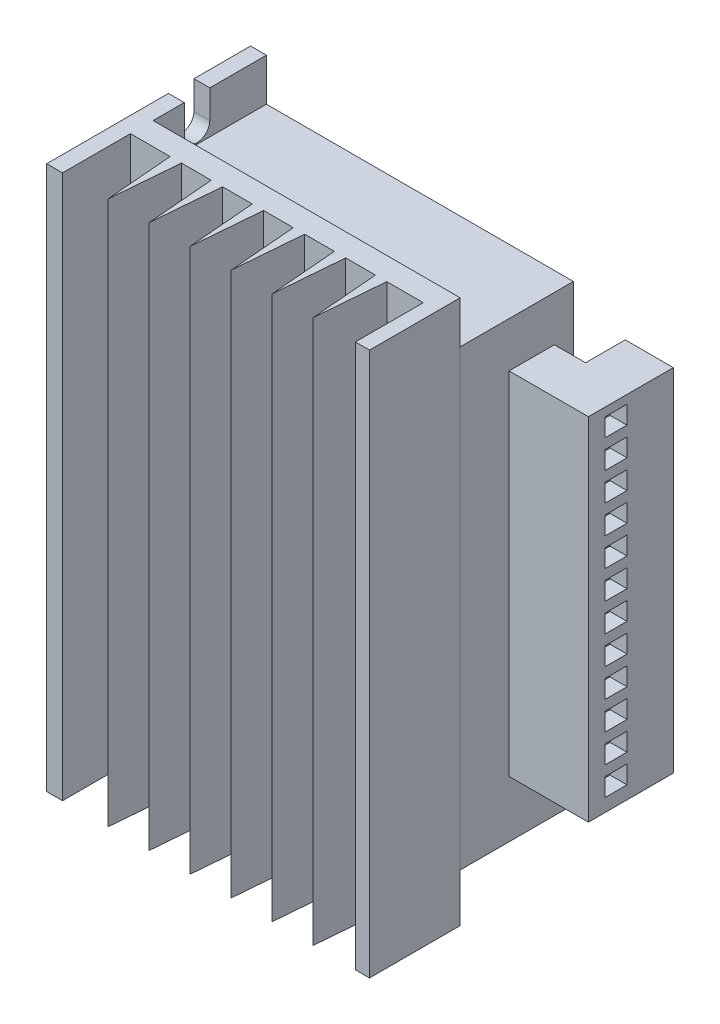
SolidWorks part; units mm, degrees
ref_plane "Front Plane" through (0, 0, 0) normal (0, 0, 1) x (1, 0, 0)
ref_plane "Top Plane" through (0, 0, 0) normal (0, 1, 0) x (1, 0, 0)
ref_plane "Right Plane" through (0, 0, 0) normal (1, 0, 0) x (0, 0, -1)
sketch "Sketch1" plane through (0, 0, 0) normal (0, 1, 0) x (1, 0, 0)
  line L0 (2.8, 16) -> (57, 16)
  line L1 (54.5, 0) -> (57, 0)
  line L2 (0, 36) -> (0, 0)
  line L3 (2.8, 12) -> (9.8, 12)
  line L4 (57, 0) -> (57, 16)
  line L5 (0, 0) -> (2.8, 0)
  line L7 (0, 36) -> (2.8, 36)
  line L8 (2.8, 16) -> (2.8, 36)
  line L9 (2.8, 12) -> (2.8, 0)
  line L10 (18.05, 0) -> (17.05, 12)
  line L11 (18.05, 0) -> (19.05, 12)
  line L12 (25.3, 0) -> (24.3, 12)
  line L13 (10.8, 0) -> (9.8, 12)
  line L14 (10.8, 0) -> (11.8, 12)
  line L15 (25.3, 0) -> (26.3, 12)
  line L16 (32.55, 0) -> (31.55, 12)
  line L17 (32.55, 0) -> (33.55, 12)
  line L18 (39.8, 0) -> (38.8, 12)
  line L19 (39.8, 0) -> (40.8, 12)
  line L20 (47.05, 0) -> (46.05, 12)
  line L21 (47.05, 0) -> (48.05, 12)
  line L22 (54.5, 0) -> (54.5, 12)
  line L23 (54.5, 0) -> (54.5, 16) construction
  line L24 (2.8, 12) -> (57, 12) construction
  line L25 (48.05, 12) -> (54.5, 12)
  line L26 (40.8, 12) -> (46.05, 12)
  line L27 (33.55, 12) -> (38.8, 12)
  line L28 (26.3, 12) -> (31.55, 12)
  line L29 (19.05, 12) -> (24.3, 12)
  line L30 (11.8, 12) -> (17.05, 12)
  dimension "D1" = 6
extrude "Boss-Extrude1" add sketch "Sketch1" along normal blind 96
sketch "Sketch2" plane through (2.8, 0, 0) normal (1, 0, 0) x (0, 0, -1)
  line L4 (16, 96) -> (16, 0) construction
  line L5 (36, 96) -> (36, 0) construction
  line L6 (16, 88.5) -> (36, 88.5)
  line L7 (16, 88.5) -> (16, 8.5)
  line L8 (16, 8.5) -> (36, 8.5)
  line L9 (36, 88.5) -> (36, 8.5)
extrude "Boss-Extrude2" add sketch "Sketch2" along normal blind 54.2 separate body contours L8 L6 M5 M3
sketch "Sketch8" plane through (2.8, 0, 0) normal (1, 0, 0) x (0, 0, -1)
  line L0 (26, 96) -> (26, 91)
  line L1 (16, 96) -> (36, 96) construction
  line L2 (21.5, 96) -> (21.5, 91)
  line L3 (21.5, 96) -> (26, 96)
  line L6 (21.5, 0) -> (26, 0)
  line L7 (21.5, 0) -> (21.5, 5)
  line L8 (26, 0) -> (26, 5)
  arc A0 (26, 91) -> (21.5, 91) centre (23.75, 91) cw
  arc A1 (26, 5) -> (21.5, 5) centre (23.75, 5) ccw
extrude "Cut-Extrude1" cut sketch "Sketch8" against normal blind 4 contours A0 L0 L2 M8 | L8 A1 L7 M6
sketch "Sketch9" plane through (57, 0, 0) normal (1, 0, 0) x (0, 0, -1)
  line L0 (16, 88.5) -> (36, 88.5) construction
  line L1 (24.6447, 80.5) -> (32.6447, 80.5)
  line L2 (24.6447, 80.5) -> (24.6447, 18.5)
  line L3 (24.6447, 18.5) -> (32.6447, 18.5)
  line L4 (32.6447, 80.5) -> (32.6447, 18.5)
  dimension "D1" = 62
  dimension "D2" = 8
  dimension "D3" = 8
extrude "Boss-Extrude4" add sketch "Sketch9" along normal blind 14 separate body
sketch "Sketch10" plane through (71, 0, 0) normal (1, 0, 0) x (0, 0, -1)
  line L2 (24.6447, 80.5) -> (39.6447, 80.5)
  line L3 (24.6447, 80.5) -> (24.6447, 18.5)
  line L4 (24.6447, 18.5) -> (39.6447, 18.5)
  line L7 (39.6447, 80.5) -> (39.6447, 18.5)
extrude "Boss-Extrude5" add sketch "Sketch10" against normal blind 8.5
sketch "Sketch11" plane through (0, 0, -39.6447) normal (0, 0, -1) x (-1, 0, 0)
  circle A0 centre (-66.1245, 77.4968) radius 1.6
  circle A1 centre (-66.1245, 72.4968) radius 1.6
  circle A2 centre (-66.1245, 67.4968) radius 1.6
  circle A3 centre (-66.1245, 62.4968) radius 1.6
  circle A4 centre (-66.1245, 57.4968) radius 1.6
  circle A5 centre (-66.1245, 52.4968) radius 1.6
  circle A6 centre (-66.1245, 47.4968) radius 1.6
  circle A7 centre (-66.1245, 42.4968) radius 1.6
  circle A8 centre (-66.1245, 37.4968) radius 1.6
  circle A9 centre (-66.1245, 32.4968) radius 1.6
  circle A10 centre (-66.1245, 27.4968) radius 1.6
  circle A11 centre (-66.1245, 22.4968) radius 1.6
extrude "Cut-Extrude2" cut sketch "Sketch11" against normal blind 1
sketch "Sketch13" plane through (0, 0, -38.6447) normal (0, 0, -1) x (-1, 0, 0)
  circle A0 centre (-66.1245, 77.4968) radius 1.5085
  circle A1 centre (-66.1245, 72.4968) radius 1.5085
  circle A2 centre (-66.1245, 67.4968) radius 1.5085
  circle A3 centre (-66.1245, 62.4968) radius 1.5085
  circle A4 centre (-66.1245, 57.4968) radius 1.5085
  circle A5 centre (-66.1245, 52.4968) radius 1.5085
  circle A6 centre (-66.1245, 47.4968) radius 1.5085
  circle A7 centre (-66.1245, 42.4968) radius 1.5085
  circle A8 centre (-66.1245, 37.4968) radius 1.5085
  circle A9 centre (-66.1245, 32.4968) radius 1.5085
  circle A10 centre (-66.1245, 27.4968) radius 1.5085
  circle A11 centre (-66.1245, 22.4968) radius 1.5085
extrude "Boss-Extrude6" add sketch "Sketch13" along normal blind 0.5 separate body
fillet "Fillet19" radius 0.5 1 edges at (66.1245, 79.0053, -39.1447)
fillet "Fillet20" radius 0.5 1 edges at (66.1245, 74.0053, -39.1447)
fillet "Fillet21" radius 0.5 1 edges at (66.1245, 69.0053, -39.1447)
fillet "Fillet22" radius 0.5 1 edges at (66.1245, 64.0053, -39.1447)
fillet "Fillet23" radius 0.5 1 edges at (66.1245, 59.0053, -39.1447)
fillet "Fillet24" radius 0.5 1 edges at (66.1245, 54.0053, -39.1447)
fillet "Fillet25" radius 0.5 1 edges at (66.1245, 49.0053, -39.1447)
fillet "Fillet26" radius 0.5 1 edges at (66.1245, 44.0053, -39.1447)
fillet "Fillet27" radius 0.5 1 edges at (66.1245, 39.0053, -39.1447)
fillet "Fillet28" radius 0.5 1 edges at (66.1245, 34.0053, -39.1447)
fillet "Fillet29" radius 0.5 1 edges at (66.1245, 29.0053, -39.1447)
fillet "Fillet30" radius 0.5 1 edges at (66.1245, 24.0053, -39.1447)
sketch "Sketch15" plane through (0, 0, -39.1447) normal (0, 0, -1) x (-1, 0, 0)
  line L0 (-65.5267, 71.1211) -> (-66.2369, 73.9926)
  line L1 (-65.5267, 76.1211) -> (-66.2369, 78.9926)
  line L2 (-66.012, 76.001) -> (-66.7223, 78.8725)
  line L3 (-66.012, 71.001) -> (-66.7223, 73.8725)
  line L4 (-65.5267, 66.1211) -> (-66.2369, 68.9926)
  line L5 (-66.012, 66.001) -> (-66.7223, 68.8725)
  line L6 (-65.5267, 61.1211) -> (-66.2369, 63.9926)
  line L7 (-66.012, 61.001) -> (-66.7223, 63.8725)
  line L8 (-65.5267, 56.1211) -> (-66.2369, 58.9926)
  line L9 (-66.012, 56.001) -> (-66.7223, 58.8725)
  line L10 (-65.5267, 51.1211) -> (-66.2369, 53.9926)
  line L11 (-66.012, 51.001) -> (-66.7223, 53.8725)
  line L12 (-65.5267, 46.1211) -> (-66.2369, 48.9926)
  line L13 (-66.012, 46.001) -> (-66.7223, 48.8725)
  line L14 (-65.5267, 41.1211) -> (-66.2369, 43.9926)
  line L15 (-66.012, 41.001) -> (-66.7223, 43.8725)
  line L16 (-65.5267, 36.1211) -> (-66.2369, 38.9926)
  line L17 (-66.012, 36.001) -> (-66.7223, 38.8725)
  line L18 (-65.5267, 31.1211) -> (-66.2369, 33.9926)
  line L19 (-66.012, 31.001) -> (-66.7223, 33.8725)
  line L20 (-65.5267, 26.1211) -> (-66.2369, 28.9926)
  line L21 (-66.012, 26.001) -> (-66.7223, 28.8725)
  line L22 (-65.5267, 21.1211) -> (-66.2369, 23.9926)
  line L23 (-66.012, 21.001) -> (-66.7223, 23.8725)
  arc A0 (-66.2369, 78.9926) -> (-66.7223, 78.8725) centre (-66.1245, 77.4968) ccw
  arc A1 (-66.012, 76.001) -> (-65.5267, 76.1211) centre (-66.1245, 77.4968) ccw
  arc A2 (-66.2369, 73.9926) -> (-66.7223, 73.8725) centre (-66.1245, 72.4968) ccw
  arc A3 (-66.012, 71.001) -> (-65.5267, 71.1211) centre (-66.1245, 72.4968) ccw
  arc A4 (-66.2369, 68.9926) -> (-66.7223, 68.8725) centre (-66.1245, 67.4968) ccw
  arc A5 (-66.012, 66.001) -> (-65.5267, 66.1211) centre (-66.1245, 67.4968) ccw
  arc A6 (-66.2369, 63.9926) -> (-66.7223, 63.8725) centre (-66.1245, 62.4968) ccw
  arc A7 (-66.012, 61.001) -> (-65.5267, 61.1211) centre (-66.1245, 62.4968) ccw
  arc A8 (-66.2369, 58.9926) -> (-66.7223, 58.8725) centre (-66.1245, 57.4968) ccw
  arc A9 (-66.012, 56.001) -> (-65.5267, 56.1211) centre (-66.1245, 57.4968) ccw
  arc A10 (-66.2369, 53.9926) -> (-66.7223, 53.8725) centre (-66.1245, 52.4968) ccw
  arc A11 (-66.012, 51.001) -> (-65.5267, 51.1211) centre (-66.1245, 52.4968) ccw
  arc A12 (-66.2369, 48.9926) -> (-66.7223, 48.8725) centre (-66.1245, 47.4968) ccw
  arc A13 (-66.012, 46.001) -> (-65.5267, 46.1211) centre (-66.1245, 47.4968) ccw
  arc A14 (-66.2369, 43.9926) -> (-66.7223, 43.8725) centre (-66.1245, 42.4968) ccw
  arc A15 (-66.012, 41.001) -> (-65.5267, 41.1211) centre (-66.1245, 42.4968) ccw
  arc A16 (-66.2369, 38.9926) -> (-66.7223, 38.8725) centre (-66.1245, 37.4968) ccw
  arc A17 (-66.012, 36.001) -> (-65.5267, 36.1211) centre (-66.1245, 37.4968) ccw
  arc A18 (-66.2369, 33.9926) -> (-66.7223, 33.8725) centre (-66.1245, 32.4968) ccw
  arc A19 (-66.012, 31.001) -> (-65.5267, 31.1211) centre (-66.1245, 32.4968) ccw
  arc A20 (-66.2369, 28.9926) -> (-66.7223, 28.8725) centre (-66.1245, 27.4968) ccw
  arc A21 (-66.012, 26.001) -> (-65.5267, 26.1211) centre (-66.1245, 27.4968) ccw
  arc A22 (-66.2369, 23.9926) -> (-66.7223, 23.8725) centre (-66.1245, 22.4968) ccw
  arc A23 (-66.012, 21.001) -> (-65.5267, 21.1211) centre (-66.1245, 22.4968) ccw
extrude "Cut-Extrude4" cut sketch "Sketch15" against normal blind 0.25
sketch "Sketch16" plane through (71, 0, 0) normal (1, 0, 0) x (0, 0, -1)
  line L1 (27.5359, 79) -> (31.4621, 79)
  line L2 (27.5359, 79) -> (27.5359, 75.8)
  line L3 (27.5359, 75.8) -> (31.4621, 75.8)
  line L4 (31.4621, 79) -> (31.4621, 75.8)
  line L6 (27.5359, 74) -> (31.4621, 74)
  line L7 (27.5359, 74) -> (27.5359, 70.8)
  line L8 (27.5359, 70.8) -> (31.4621, 70.8)
  line L9 (31.4621, 74) -> (31.4621, 70.8)
  line L10 (27.5359, 69) -> (31.4621, 69)
  line L11 (27.5359, 69) -> (27.5359, 65.8)
  line L12 (27.5359, 65.8) -> (31.4621, 65.8)
  line L13 (31.4621, 69) -> (31.4621, 65.8)
  line L14 (27.5359, 64) -> (31.4621, 64)
  line L15 (27.5359, 64) -> (27.5359, 60.8)
  line L16 (27.5359, 60.8) -> (31.4621, 60.8)
  line L17 (31.4621, 64) -> (31.4621, 60.8)
  line L18 (27.5359, 59) -> (31.4621, 59)
  line L19 (27.5359, 59) -> (27.5359, 55.8)
  line L20 (27.5359, 55.8) -> (31.4621, 55.8)
  line L21 (31.4621, 59) -> (31.4621, 55.8)
  line L22 (27.5359, 54) -> (31.4621, 54)
  line L23 (27.5359, 54) -> (27.5359, 50.8)
  line L24 (27.5359, 50.8) -> (31.4621, 50.8)
  line L25 (31.4621, 54) -> (31.4621, 50.8)
  line L26 (27.5359, 49) -> (31.4621, 49)
  line L27 (27.5359, 49) -> (27.5359, 45.8)
  line L28 (27.5359, 45.8) -> (31.4621, 45.8)
  line L29 (31.4621, 49) -> (31.4621, 45.8)
  line L30 (27.5359, 44) -> (31.4621, 44)
  line L31 (27.5359, 44) -> (27.5359, 40.8)
  line L32 (27.5359, 40.8) -> (31.4621, 40.8)
  line L33 (31.4621, 44) -> (31.4621, 40.8)
  line L34 (27.5359, 39) -> (31.4621, 39)
  line L35 (27.5359, 39) -> (27.5359, 35.8)
  line L36 (27.5359, 35.8) -> (31.4621, 35.8)
  line L37 (31.4621, 39) -> (31.4621, 35.8)
  line L38 (27.5359, 34) -> (31.4621, 34)
  line L39 (27.5359, 34) -> (27.5359, 30.8)
  line L40 (27.5359, 30.8) -> (31.4621, 30.8)
  line L41 (31.4621, 34) -> (31.4621, 30.8)
  line L42 (27.5359, 29) -> (31.4621, 29)
  line L43 (27.5359, 29) -> (27.5359, 25.8)
  line L44 (27.5359, 25.8) -> (31.4621, 25.8)
  line L45 (31.4621, 29) -> (31.4621, 25.8)
  line L46 (27.5359, 24) -> (31.4621, 24)
  line L47 (27.5359, 24) -> (27.5359, 20.8)
  line L48 (27.5359, 20.8) -> (31.4621, 20.8)
  line L49 (31.4621, 24) -> (31.4621, 20.8)
extrude "Cut-Extrude5" cut sketch "Sketch16" against normal blind 3
